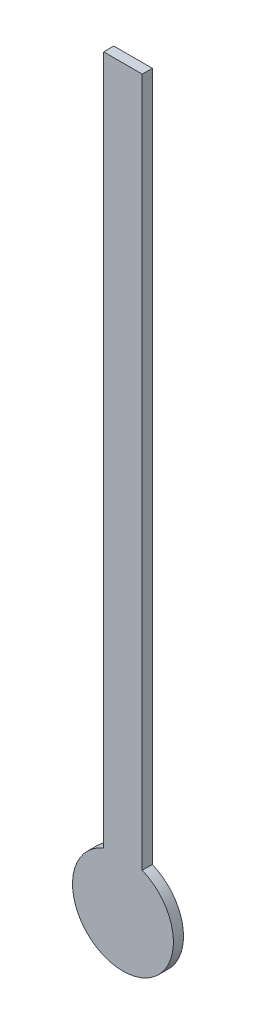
SolidWorks part; units mm, degrees
ref_plane "Ebene vorne" through (0, 0, 0) normal (0, 0, 1) x (1, 0, 0)
ref_plane "Ebene oben" through (0, 0, 0) normal (0, 1, 0) x (1, 0, 0)
ref_plane "Ebene rechts" through (0, 0, 0) normal (1, 0, 0) x (0, 0, -1)
sketch "Skizze1" plane through (0, 0, 0) normal (0, 0, 1) x (1, 0, 0)
  line L2 (-1.9123, 4.6199) -> (-1.9123, 72.9846)
  line L3 (-1.9123, 72.9846) -> (1.9123, 72.9846)
  line L4 (1.9123, 4.6199) -> (1.9123, 72.9846)
  arc A0 (-1.9123, 4.6199) -> (1.9123, 4.6199) centre (0, 0) ccw
  dimension "D1" = 10
extrude "Linear austragen1" add sketch "Skizze1" along normal blind 1
